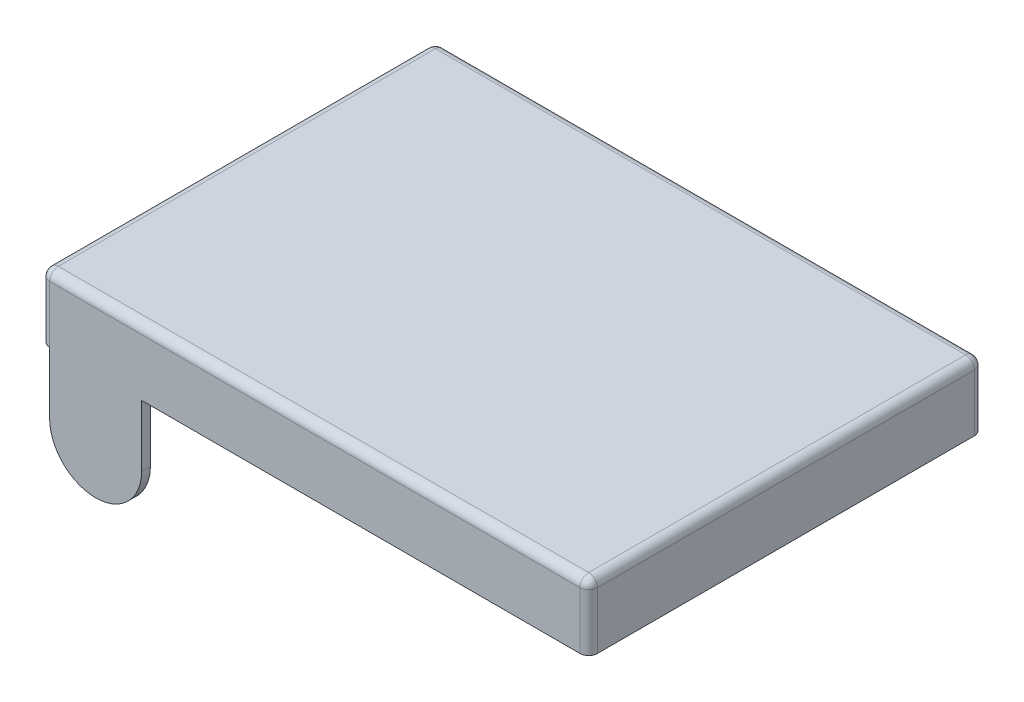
SolidWorks part; units mm, degrees
ref_plane "Front Plane" through (0, 0, 0) normal (0, 0, 1) x (1, 0, 0)
ref_plane "Top Plane" through (0, 0, 0) normal (0, 1, 0) x (1, 0, 0)
ref_plane "Right Plane" through (0, 0, 0) normal (1, 0, 0) x (0, 0, -1)
sketch "Sketch1" plane through (0, 0, 0) normal (0, 1, 0) x (1, 0, 0)
  line L0 (-62.5, 45) -> (62.5, -45) construction
  line L1 (-62.5, -45) -> (62.5, -45)
  line L2 (-62.5, -45) -> (-62.5, 45)
  line L3 (-62.5, 45) -> (62.5, 45)
  line L4 (62.5, -45) -> (62.5, 45)
  dimension "D1" = 125
  dimension "D3" = 90
extrude "Extrude1" add sketch "Sketch1" along normal blind 15
fillet "Fillet3" radius 2 4 edges at (62.5, 7.5, -45) (62.5, 7.5, 45) (-62.5, 7.5, -45) (-62.5, 7.5, 45)
fillet "Fillet4" radius 2 8 edges at (-61.9142, 15, 44.4142) (-62.5, 15, 0) (-61.9142, 15, -44.4142) (0, 15, -45) (61.9142, 15, -44.4142) (62.5, 15, 0) (61.9142, 15, 44.4142) (0, 15, 45)
shell "Shell1" thickness 2
sketch "Sketch4" plane through (0, 0, 45) normal (0, 0, 1) x (1, 0, 0)
  line L0 (-60.5, 0) -> (-60.5, -14)
  line L1 (-39.5, -14) -> (-39.5, 0)
  line L2 (-60.5, 0) -> (60.5, 0) construction
  line L3 (-62.5, 0) -> (-62.5, 13) construction
  line L8 (60.5, 0) -> (60.5, 13)
  line L9 (60.5, 13) -> (-60.5, 13)
  line L10 (-60.5, 13) -> (-60.5, 0)
  line L11 (-60.5, 0) -> (60.5, 0)
  line L15 (-60.5, 0) -> (-39.5, 0)
  arc A0 (-60.5, -14) -> (-39.5, -14) centre (-50, -14) ccw
  dimension "D2" = 14
  dimension "D1" = 12.5
  dimension "D3" = 0
extrude "Extrude3" add sketch "Sketch4" against normal blind 2
hole_wizard "Hole1" positions "3DSketch2" profile "Sketch5" legacy
sketch3d "3DSketch2"
  line L0 (-50, -14, 43) -> (-50, -14, 45) construction
  point P0 (-50, -14, 43)
sketch "Sketch5" plane through (-50, -14, 43) normal (1, 0, 0) x (0, 1, 0)
  line L0 (0, 0) -> (0, 1)
  line L1 (0, 1) -> (1.25, 1)
  line L2 (1.25, 1) -> (1.25, 0)
  line L3 (1.25, 0) -> (0, 0)
  line L4 (0, 110) -> (0, -10) construction
  dimension "Diameter" = 2.5
  dimension "Depth" = 1
mirror "Mirror5" about plane through (0, 0, 0) normal (0, 0, 1) of "Hole1", "Extrude3"
